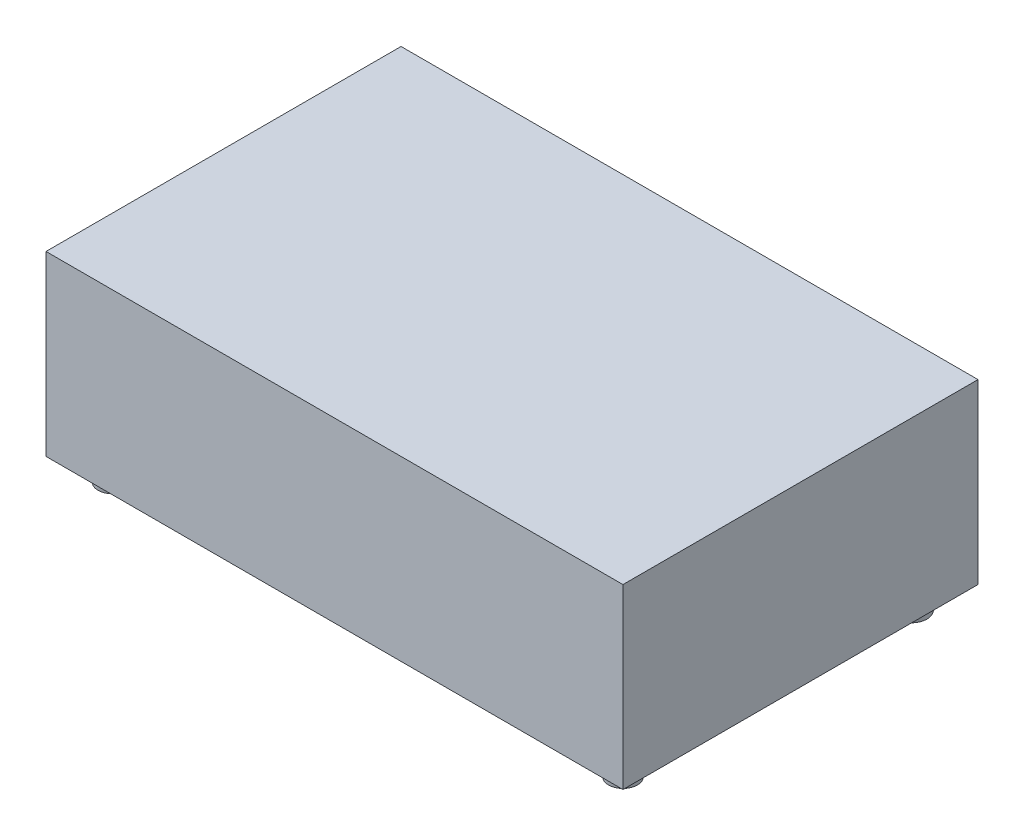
SolidWorks part; units mm, degrees
ref_plane "前基準面" through (0, 0, 0) normal (0, 0, 1) x (1, 0, 0)
ref_plane "上基準面" through (0, 0, 0) normal (0, 1, 0) x (1, 0, 0)
ref_plane "右基準面" through (0, 0, 0) normal (1, 0, 0) x (0, 0, -1)
sketch "草圖1" plane through (0, 0, 0) normal (0, 0, 1) x (1, 0, 0)
  line L1 (0, 0) -> (260, 0)
  line L2 (0, 0) -> (0, -80)
  line L3 (0, -80) -> (260, -80)
  line L4 (260, 0) -> (260, -80)
  dimension "D1" = 260
  dimension "D2" = 80
extrude "填料-伸長1" add sketch "草圖1" along normal blind 160
sketch "草圖2" plane through (0, -80, 0) normal (0, -1, 0) x (1, 0, 0)
  line L0 (0, 160) -> (0, 0) construction
  line L1 (0, 160) -> (260, 160) construction
  line L2 (260, 160) -> (260, 0) construction
  line L3 (0, 0) -> (260, 0) construction
  circle A0 centre (15, 145) radius 7.5
  circle A1 centre (245, 145) radius 7.5
  circle A2 centre (15, 15) radius 8
  circle A3 centre (245, 15) radius 8
  dimension "D1" = 15
  dimension "D2" = 15
  dimension "D7" = 16
  dimension "D8" = 16
  dimension "D3" = 15
  dimension "D4" = 15
  dimension "D5" = 15
  dimension "D6" = 15
  dimension "D9" = 15
  dimension "D10" = 15
extrude "填料-伸長2" add sketch "草圖2" along normal blind 10
chamfer "導角1" distance 10 distance2 1 4 edges at (15, -90, 7) (245, -90, 7) (245, -90, 137.5) (15, -90, 137.5)
